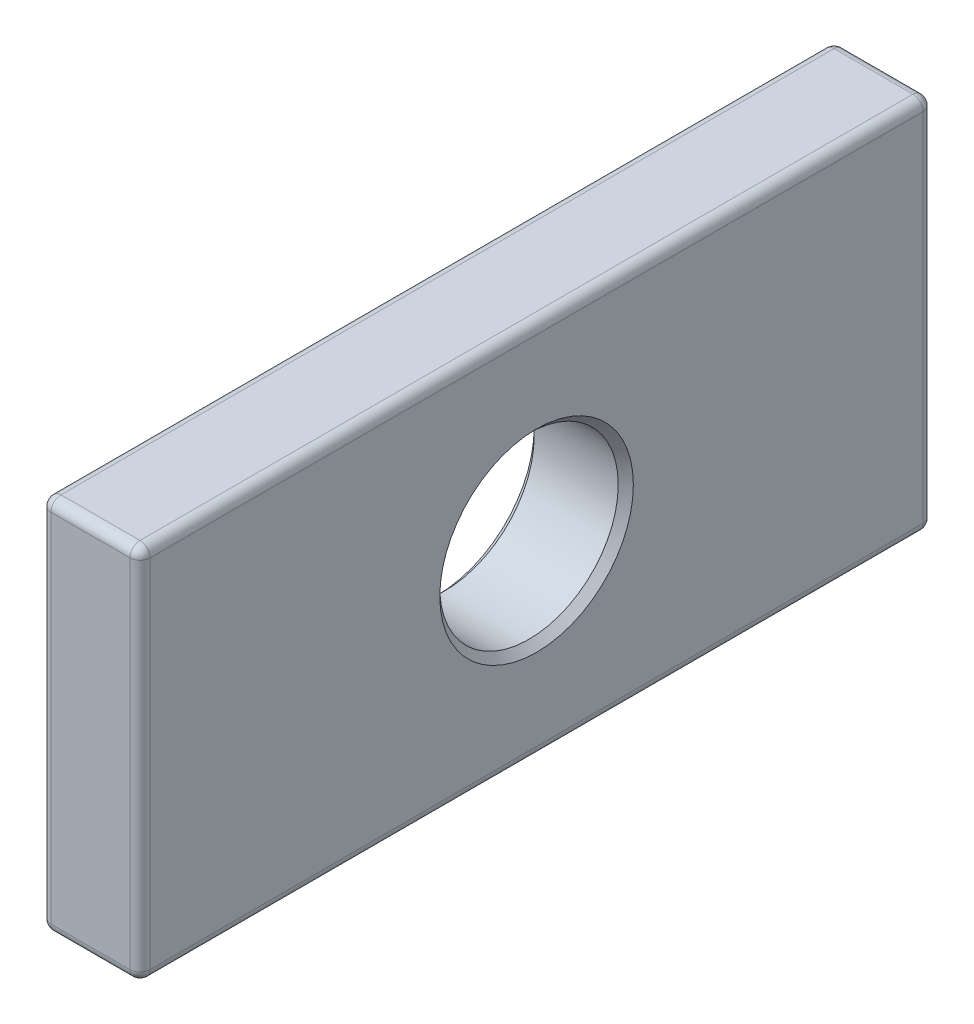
SolidWorks part; units mm, degrees
ref_plane "Front Plane" through (0, 0, 0) normal (0, 0, 1) x (1, 0, 0)
ref_plane "Top Plane" through (0, 0, 0) normal (0, 1, 0) x (1, 0, 0)
ref_plane "Right Plane" through (0, 0, 0) normal (1, 0, 0) x (0, 0, -1)
sketch "Sketch1" plane through (0, 0, 0) normal (1, 0, 0) x (0, 0, -1)
  line L1 (-40, 19) -> (40, 19)
  line L2 (-40, 19) -> (-40, -19)
  line L3 (-40, -19) -> (40, -19)
  line L4 (40, 19) -> (40, -19)
  line L5 (-40, 19) -> (40, -19) construction
  line L6 (-40, -19) -> (40, 19) construction
  circle A0 centre (0, 0) radius 9
  point P0 (0, 0)
  dimension "D3" = 18
  dimension "D1" = 38
  dimension "D2" = 80
extrude "Boss-Extrude1" add sketch "Sketch1" along normal mid plane 10
fillet "Fillet1" radius 1.016 12 edges at (0, -19, -40) (0, 19, -40) (-5, 19, 0) (-5, -19, 0) (-5, 0, -40) (0, 19, 40) (0, -19, 40) (-5, 0, 40) (5, -19, 0) (5, 0, 40) (5, 19, 0) (5, 0, -40)
chamfer "Chamfer1" distance 0.762 angle 45 2 edges at (-5, 0, -9) (5, 0, -9)
